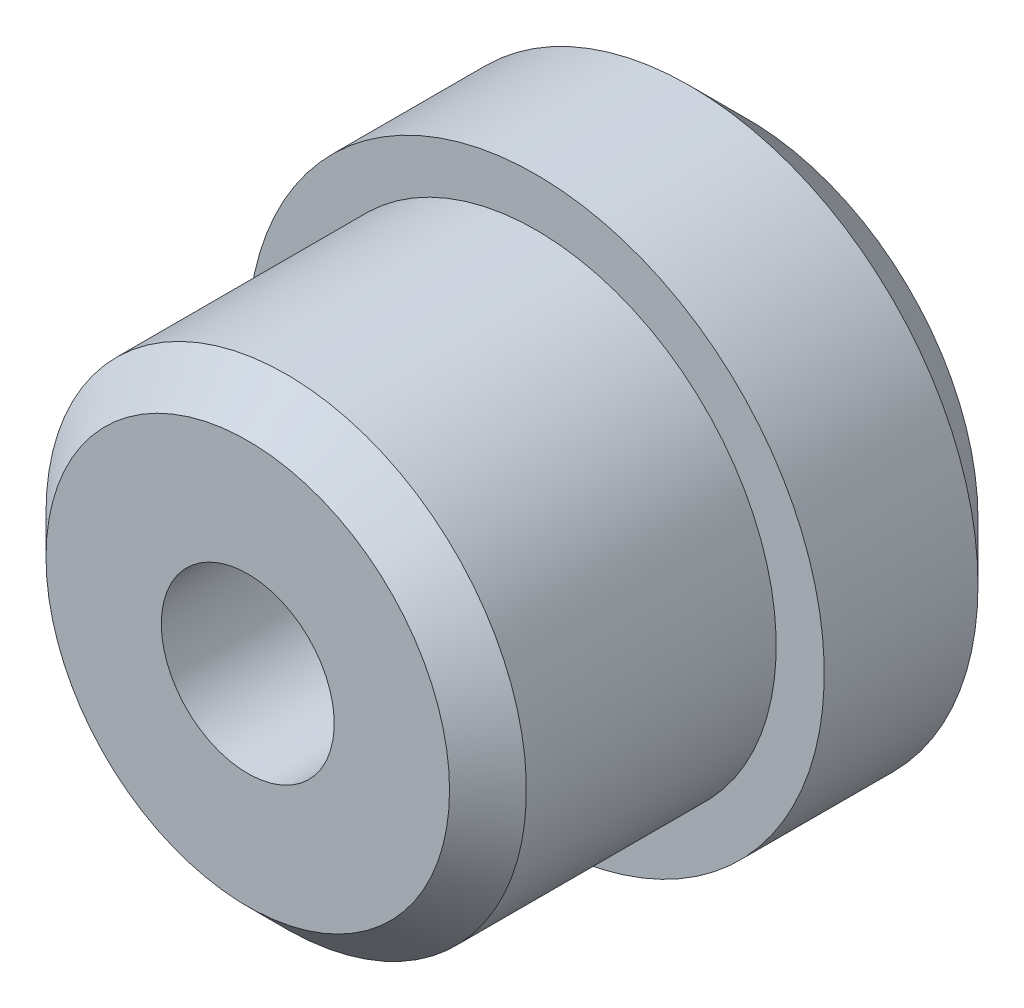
SolidWorks part; units mm, degrees
ref_plane "Plan de face" through (0, 0, 0) normal (0, 0, 1) x (1, 0, 0)
ref_plane "Plan de dessus" through (0, 0, 0) normal (0, 1, 0) x (1, 0, 0)
ref_plane "Plan de droite" through (0, 0, 0) normal (1, 0, 0) x (0, 0, -1)
sketch "Esquisse1" plane through (0, 0, 0) normal (0, 0, 1) x (1, 0, 0)
  circle A0 centre (0, 0) radius 12.5
  dimension "D1" = 25
extrude "Extrusion1" add sketch "Esquisse1" along normal blind 26
chamfer "Chanfrein1" distance 2 angle 45 1 edges at (12.5, 0, 26)
hole_wizard "Chambrage pour vis à tête cylindrique à 6 pans creux (ou vis CHC) M81" positions "Esquisse3D1" profile "Esquisse2" counterbore size "M8" standard "Ansi Métrique"
sketch3d "Esquisse3D1"
  point P9 (0, 0, 0)
  point P13 (0, 0, 0)
sketch "Esquisse2" plane through (0, 0, 0) normal (1, 0, 0) x (0, 1, 0)
  line L0 (0, 0) -> (0, 26)
  line L1 (0, 26) -> (4.5, 26)
  line L3 (4.5, 26) -> (4.5, 13)
  line L4 (4.5, 13) -> (7.5, 13)
  line L5 (7.5, 13) -> (7.5, 0)
  line L7 (7.5, 0) -> (0, 0)
  line L11 (0, -6.35) -> (0, 107.95) construction
  dimension "Diamètre du perçage jusqu'au prochain" = 9
  dimension "Profondeur du perçage jusqu'au prochain" = 26
  dimension "Diamètre du chambrage" = 15
  dimension "Profondeur du chambrage" = 13
sketch "Esquisse3" plane through (0, 0, 26) normal (0, 0, 1) x (1, 0, 0)
  point P0 (0, 0)
sketch "Esquisse4" plane through (0, 0, 13) normal (0, 0, -1) x (-1, 0, 0)
  point P0 (0, 0)
sketch "Esquisse5" plane through (0, 0, 0) normal (0, 0, -1) x (-1, 0, 0)
  circle A0 centre (0, 0) radius 15
  circle A1 centre (0, 0) radius 12.5
  dimension "D1" = 30
  dimension "D2" = 25
extrude "Extrusion2" add sketch "Esquisse5" against normal blind 11
chamfer "Chanfrein2" distance 3 angle 45 1 edges at (-15, 0, 0)
